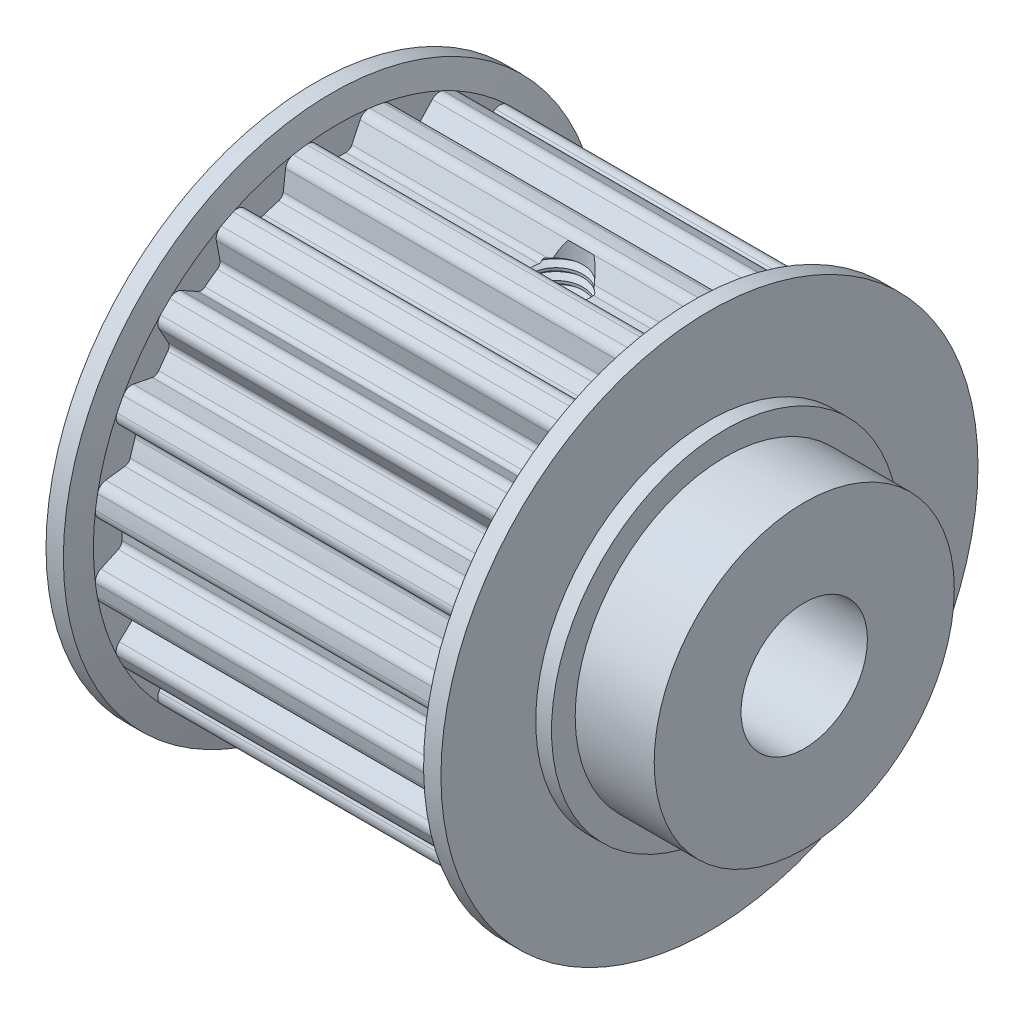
SolidWorks part; units mm, degrees
ref_plane "Front" through (0, 0, 0) normal (0, 0, 1) x (1, 0, 0)
ref_plane "Top" through (0, 0, 0) normal (0, 1, 0) x (1, 0, 0)
ref_plane "Right" through (0, 0, 0) normal (1, 0, 0) x (0, 0, -1)
imported_body "Hammashihnapyörä 20T5_20D8/0"
sketch "Sketch1" plane through (39, 0, 0) normal (1, 0, 0) x (0, 0, -1)
  line L0 (-1.5, 3.7081) -> (-1.5, 5.4)
  line L1 (-1.5, 5.4) -> (1.5, 5.4)
  line L2 (1.5, 5.4) -> (1.5, 3.7081)
  line L3 (3.994, 0.2194) -> (9.4857, 0.5211)
  line L4 (-3.0915, -2.5382) -> (2.3763, -9.198)
  circle A0 centre (0, 0) radius 9.5
  arc A1 (-1.5, 3.7081) -> (1.5, 3.7081) centre (0, 0) ccw
extrude "Boss-Extrude1" add sketch "Sketch1" against normal blind 10 contours L4 L3 M9 M6
sketch "Sketch2" plane through (39, 0, 0) normal (1, 0, 0) x (0, 0, -1)
  circle A0 centre (0, 0) radius 9.5
extrude "Cut-Extrude1" cut sketch "Sketch2" against normal blind 7
sketch "Sketch3" plane through (32, 0, 0) normal (1, 0, 0) x (0, 0, -1)
  arc A0 (-1.5, 3.7081) -> (1.5, 3.7081) centre (0, 0) ccw
  circle A1 centre (0, 0) radius 9.5
  circle A2 centre (0, 0) radius 4
extrude "Boss-Extrude2" add sketch "Sketch3" against normal up to surface (32 mm away)
ref_plane "Plane1" through (0, 15.0289, 0) normal (0, -1, 0) x (-1, 0, 0)
sketch "Sketch4" plane through (0, 15.0289, 0) normal (0, -1, 0) x (-1, 0, 0)
  line L0 (-24.5, -1.3793) -> (-24.5, -0.8631) construction
  circle A0 centre (-16.5, 0) radius 1.6
  dimension "D1" = 8
extrude "Cut-Extrude2" cut sketch "Sketch4" along normal up to surface (11.3629 mm away)
thread "Thread1" pitch 0.7 start angle 0, offset 0, length 10, pitch 0.7, diameter 3.2
ref_plane "Plane2" through (18.1, 13.9221, 0) normal (0, 0, 1) x (1, 0, 0)
sketch "Thread Profile1" plane through (18.1, 13.9221, 0) normal (0, 0, 1) x (1, 0, 0)
  line L0 (0, 0) -> (0, 0.7) construction
  line L1 (0, 0) -> (0.3789, 0.2187)
  line L2 (0.3789, 0.2187) -> (0.3789, 0.3062)
  line L3 (0.3789, 0.3062) -> (0, 0.525)
  line L4 (0.3789, 0.2625) -> (0, 0.2625) construction
  line L11 (0, 0) -> (0, 0.525)
  point P2 (0, 0)
  dimension "Pitch" = 0.7
  dimension "Profile_Angle" = 60
  dimension "Profile_Land" = 0.0875
  dimension "Profile_Height" = 0.3789
ref_plane "Plane3" through (13.5, 0, 0) normal (1, 0, 0) x (0, 0, -1)
sketch "Sketch7" plane through (13.5, 0, 0) normal (1, 0, 0) x (0, 0, -1)
  circle A0 centre (0, 0) radius 17.4
ref_plane "Plane4" through (0, 0, 0) normal (0, 0, 1) x (1, 0, 0)
sketch "Sketch8" plane through (0, 0, 0) normal (0, 0, 1) x (1, 0, 0)
  line L0 (-0.3027, 17) -> (27.3027, 17)
  line L2 (-0.3027, 17) -> (-0.3027, 18.3969)
  line L3 (-0.3027, 18.3969) -> (27.3027, 18.1783)
  line L4 (27.3027, 18.1783) -> (27.3027, 17)
  line L5 (-1000, 0) -> (49000, 0) construction
  point P3 (13.5, 17)
  dimension "D1" = 17
revolve "Cut-Revolve1" cut sketch "Sketch8" angle 360 about L5
sketch "Sketch9" plane through (0, 0, 0) normal (-1, 0, 0) x (0, 0, 1)
  circle A0 centre (0, 0) radius 7.2915 construction
  text T0 "20T5-20D8/0" font "Century Gothic" height 2.5
extrude "Cut-Extrude3" cut sketch "Sketch9" against normal blind 0.25
sketch "Sketch10" plane through (0.9, 0, 0) normal (-1, 0, 0) x (0, 0, 1)
  circle A0 centre (0, 0) radius 12
  circle A1 centre (0, 0) radius 18.0003
extrude "Cut-Extrude4" cut sketch "Sketch10" along normal blind 2.5
sketch "Sketch11" plane through (26.1, 0, 0) normal (1, 0, 0) x (0, 0, -1)
  circle A0 centre (0, 0) radius 12
  circle A1 centre (0, 0) radius 17.6848
extrude "Cut-Extrude5" cut sketch "Sketch11" along normal blind 2.1
sketch "Sketch12" plane through (0.9, 0, 0) normal (-1, 0, 0) x (0, 0, 1)
  circle A0 centre (0, 0) radius 12
  circle A1 centre (0, 0) radius 17
extrude "Cut-Extrude6" cut sketch "Sketch12" against normal blind 0.1
sketch "Sketch13" plane through (26.1, 0, 0) normal (1, 0, 0) x (0, 0, -1)
  circle A0 centre (0, 0) radius 12
  circle A1 centre (0, 0) radius 17
extrude "Cut-Extrude7" cut sketch "Sketch13" against normal blind 0.1
sketch "Sketch14" plane through (27, 0, 0) normal (1, 0, 0) x (0, 0, -1)
  circle A0 centre (0, 0) radius 12
  circle A1 centre (0, 0) radius 11
extrude "Cut-Extrude8" cut sketch "Sketch14" against normal up to surface (1 mm away) contours A1 M1
sketch "Sketch15" plane through (0, 0, 0) normal (-1, 0, 0) x (0, 0, 1)
  circle A0 centre (0, 0) radius 11
  circle A1 centre (0, 0) radius 12
extrude "Cut-Extrude9" cut sketch "Sketch15" against normal up to surface (1 mm away) contours A1 A0
